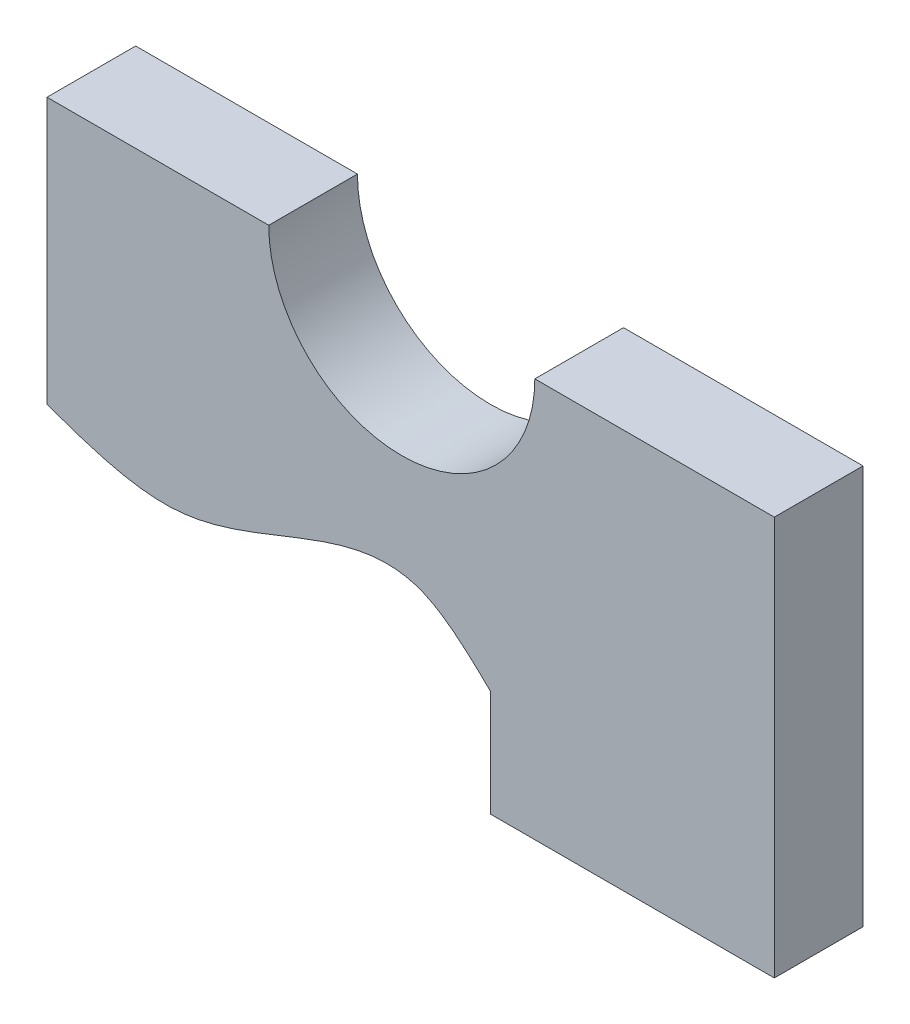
SolidWorks part; units mm, degrees
other "DetailItem1" parameters "D1"=0
ref_plane "Front Plane" through (0, 0, 0) normal (0, 0, 1) x (1, 0, 0)
ref_plane "Top Plane" through (0, 0, 0) normal (0, 1, 0) x (1, 0, 0)
ref_plane "Right Plane" through (0, 0, 0) normal (1, 0, 0) x (0, 0, -1)
sketch "Sketch1" plane through (0, 0, 0) normal (0, 0, 1) x (1, 0, 0)
  line L0 (0, 0) -> (32, 0)
  line L1 (0, 0) -> (0, 12)
  line L3 (-50, 15) -> (-50, 45)
  line L4 (-50, 45) -> (-25, 45)
  line L5 (5, 45) -> (32, 45)
  line L6 (32, 45) -> (32, 0)
  arc A0 (-25, 45) -> (5, 45) centre (-10, 45) ccw
  point P0 (-8, 18)
  point P12 (-35, 12)
  dimension "D1" = 15
  dimension "D2" = 32
  dimension "D3" = 10
  dimension "D4" = 12
  dimension "D5" = 50
  dimension "D6" = 15
  dimension "D7" = 45
  dimension "D8" = 35
  dimension "D9" = 8
  dimension "D10" = 18
  dimension "D11" = 12
extrude "Extrude1" add sketch "Sketch1" along normal blind 10
sketch "Sketch2" plane through (0, 0, 10) normal (0, 0, 1) x (1, 0, 0)
  line L6 (0, 12) -> (0, 0)
  line L7 (0, 0) -> (32, 0)
  line L8 (32, 0) -> (32, 45)
  line L9 (32, 45) -> (5, 45)
  line L10 (-25, 45) -> (-50, 45)
  line L11 (-50, 45) -> (-50, 15)
  line L12 (0, 12) -> (0, 0)
  line L13 (0, 0) -> (32, 0)
  line L14 (32, 0) -> (32, 45)
  line L15 (32, 45) -> (5, 45)
  line L16 (-25, 45) -> (-50, 45)
  line L17 (-50, 45) -> (-50, 15)
  arc A1 (-25, 45) -> (5, 45) centre (-10, 45) ccw
  arc A2 (-25, 45) -> (5, 45) centre (-10, 45) ccw
